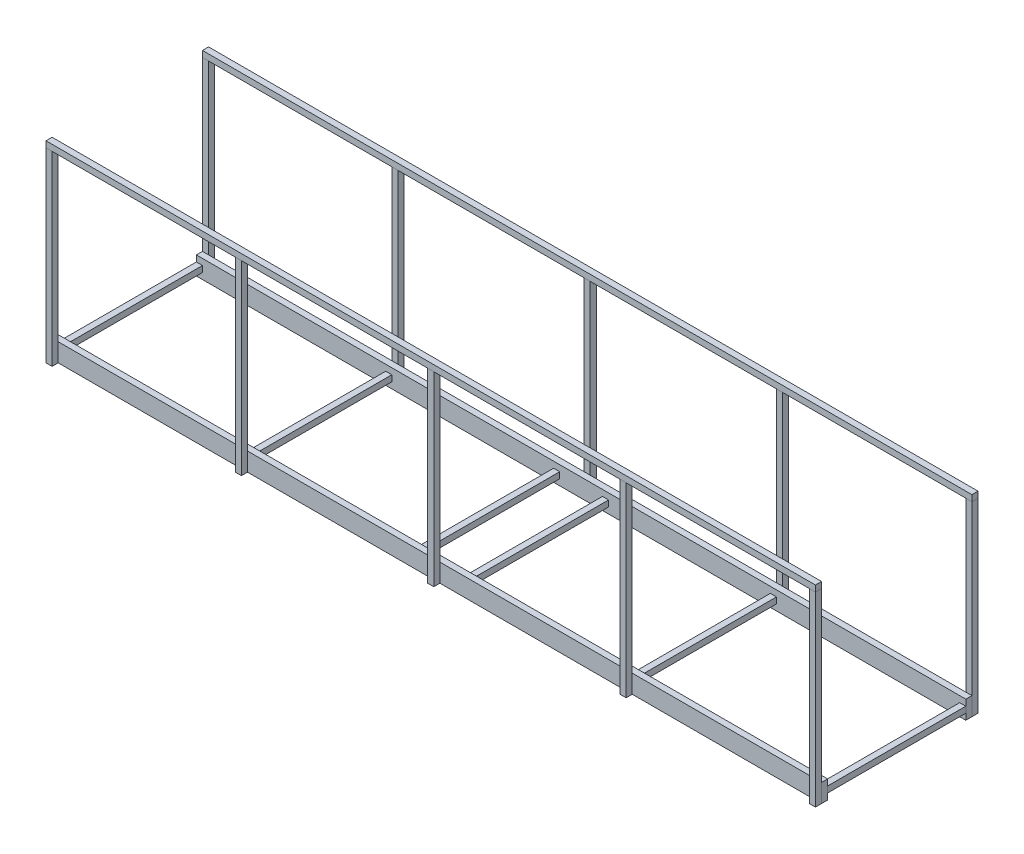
SolidWorks part; units mm, degrees
ref_plane "Front Plane" through (0, 0, 0) normal (0, 0, 1) x (1, 0, 0)
ref_plane "Top Plane" through (0, 0, 0) normal (0, 1, 0) x (1, 0, 0)
ref_plane "Right Plane" through (0, 0, 0) normal (1, 0, 0) x (0, 0, -1)
sketch "Sketch1" plane through (0, 0, 0) normal (0, 1, 0) x (1, 0, 0)
  line L0 (0, 37.5) -> (0, -37.5) construction
  line L1 (-200, -37.5) -> (200, -37.5)
  line L2 (-200, -37.5) -> (-200, 37.5)
  line L3 (-200, 37.5) -> (200, 37.5)
  line L4 (200, -37.5) -> (200, 37.5)
  line L5 (-200, -37.5) -> (200, 37.5) construction
  line L6 (-200, 37.5) -> (200, -37.5) construction
  line L7 (-100, 37.5) -> (-100, -37.5)
  line L8 (-12.7, -37.5) -> (-12.7, 37.5)
  line L9 (12.7, 37.5) -> (12.7, -37.5)
  line L10 (100, 37.5) -> (100, -37.5)
  point P0 (0, 0)
  dimension "D1" = 400
  dimension "D2" = 75
  dimension "D3" = 25.4
  dimension "D4" = 100
  dimension "D5" = 100
other "Structural Member1"
ref_plane "Plane1" through (-200, 0, 37.5) normal (1, 0, 0) x (0, 0, -1)
sketch "Sketch12" plane through (-200, 0, 37.5) normal (1, 0, 0) x (0, 0, -1)
  line L1 (-1.5875, -4.7625) -> (1.5875, -4.7625)
  line L2 (-1.5875, -4.7625) -> (-1.5875, 4.7625)
  line L3 (-1.5875, 4.7625) -> (1.5875, 4.7625)
  line L4 (1.5875, -4.7625) -> (1.5875, 4.7625)
  line L5 (-1.5875, -4.7625) -> (1.5875, 4.7625) construction
  line L6 (-1.5875, 4.7625) -> (1.5875, -4.7625) construction
  point P0 (0, 0)
  point P5 (0, 4.7625)
  point P6 (1.5875, 0)
  point P7 (0, -4.7625)
  point P8 (-1.5875, 0)
  point P9 (0, 0)
  dimension "D1" = 3.175
  dimension "D2" = 9.525
other "Structural Member2"
ref_plane "Plane2" through (200, 0, 37.5) normal (0, 0, -1) x (-1, 0, 0)
sketch "Sketch14" plane through (198.4125, 0, 37.5) normal (0, 0, -1) x (-1, 0, 0)
  line L1 (-1.5875, -1.5875) -> (1.5875, -1.5875)
  line L2 (-1.5875, -1.5875) -> (-1.5875, 1.5875)
  line L3 (-1.5875, 1.5875) -> (1.5875, 1.5875)
  line L4 (1.5875, -1.5875) -> (1.5875, 1.5875)
  line L5 (-1.5875, -1.5875) -> (1.5875, 1.5875) construction
  line L6 (-1.5875, 1.5875) -> (1.5875, -1.5875) construction
  point P0 (0, 0)
  point P5 (-1.5875, 0)
  point P6 (0, 1.5875)
  point P7 (1.5875, 0)
  point P8 (0, -1.5875)
  point P9 (0, 0)
  dimension "D1" = 3.175
other "Structural Member3"
ref_plane "Plane3" through (-200, 0, 37.5) normal (0, 0, -1) x (-1, 0, 0)
sketch "Sketch15" plane through (-198.4125, 0, 37.5) normal (0, 0, -1) x (-1, 0, 0)
  line L1 (-1.5875, -1.5875) -> (1.5875, -1.5875)
  line L2 (-1.5875, -1.5875) -> (-1.5875, 1.5875)
  line L3 (-1.5875, 1.5875) -> (1.5875, 1.5875)
  line L4 (1.5875, -1.5875) -> (1.5875, 1.5875)
  line L5 (-1.5875, -1.5875) -> (1.5875, 1.5875) construction
  line L6 (-1.5875, 1.5875) -> (1.5875, -1.5875) construction
  point P0 (0, 0)
  point P5 (-1.5875, 0)
  point P6 (0, 1.5875)
  point P7 (1.5875, 0)
  point P8 (0, -1.5875)
  point P9 (0, 0)
  dimension "D1" = 3.175
other "Structural Member4"
ref_plane "Plane4" through (-100, 0, -37.5) normal (0, 0, 1) x (1, 0, 0)
sketch "Sketch16" plane through (-100, 0, -37.5) normal (0, 0, 1) x (1, 0, 0)
  line L1 (-1.5875, -1.5875) -> (1.5875, -1.5875)
  line L2 (-1.5875, -1.5875) -> (-1.5875, 1.5875)
  line L3 (-1.5875, 1.5875) -> (1.5875, 1.5875)
  line L4 (1.5875, -1.5875) -> (1.5875, 1.5875)
  line L5 (-1.5875, -1.5875) -> (1.5875, 1.5875) construction
  line L6 (-1.5875, 1.5875) -> (1.5875, -1.5875) construction
  point P0 (0, 0)
  point P5 (-1.5875, 0)
  point P6 (0, 1.5875)
  point P7 (1.5875, 0)
  point P8 (0, -1.5875)
  point P9 (0, 0)
  dimension "D1" = 3.175
other "Trim/Extend1"
sketch "Sketch18" plane through (0, 0, 39.0875) normal (0, 0, 1) x (1, 0, 0)
  line L0 (-200, -4.7625) -> (-200, 95.2375)
  line L1 (-200, 95.2375) -> (200, 95.2375)
  line L2 (200, -4.7625) -> (200, 95.2375)
  line L3 (0, -4.7625) -> (0, 95.2375)
  line L4 (200, -4.7625) -> (-200, -4.7625) construction
  line L5 (-100, 95.2375) -> (-100, -4.7625)
  line L6 (100, 95.2375) -> (100, -4.7625)
  dimension "D1" = 100
  dimension "D2" = 100
  dimension "D3" = 100
other "Structural Member5"
ref_plane "Plane5" through (-200, -4.7625, 39.0875) normal (0, 1, 0) x (-1, 0, 0)
sketch "Sketch17" plane through (-198.4125, -4.7625, 40.675) normal (0, 1, 0) x (-1, 0, 0)
  line L1 (-1.5875, -1.5875) -> (1.5875, -1.5875)
  line L2 (-1.5875, -1.5875) -> (-1.5875, 1.5875)
  line L3 (-1.5875, 1.5875) -> (1.5875, 1.5875)
  line L4 (1.5875, -1.5875) -> (1.5875, 1.5875)
  line L5 (-1.5875, -1.5875) -> (1.5875, 1.5875) construction
  line L6 (-1.5875, 1.5875) -> (1.5875, -1.5875) construction
  point P0 (0, 0)
  point P5 (-1.5875, 0)
  point P6 (0, 1.5875)
  point P7 (1.5875, 0)
  point P8 (0, -1.5875)
  point P9 (0, 0)
  dimension "D1" = 3.175
other "Structural Member6"
ref_plane "Plane6" through (200, -4.7625, 39.0875) normal (0, 1, 0) x (-1, 0, 0)
sketch "Sketch19" plane through (198.4125, -4.7625, 40.675) normal (0, 1, 0) x (-1, 0, 0)
  line L1 (-1.5875, -1.5875) -> (1.5875, -1.5875)
  line L2 (-1.5875, -1.5875) -> (-1.5875, 1.5875)
  line L3 (-1.5875, 1.5875) -> (1.5875, 1.5875)
  line L4 (1.5875, -1.5875) -> (1.5875, 1.5875)
  line L5 (-1.5875, -1.5875) -> (1.5875, 1.5875) construction
  line L6 (-1.5875, 1.5875) -> (1.5875, -1.5875) construction
  point P0 (0, 0)
  point P5 (-1.5875, 0)
  point P6 (0, 1.5875)
  point P7 (1.5875, 0)
  point P8 (0, -1.5875)
  point P9 (0, 0)
  dimension "D1" = 3.175
other "Structural Member7"
ref_plane "Plane7" through (100, 95.2375, 39.0875) normal (0, -1, 0) x (1, 0, 0)
sketch "Sketch110" plane through (100, 95.2375, 40.675) normal (0, -1, 0) x (1, 0, 0)
  line L1 (-1.5875, -1.5875) -> (1.5875, -1.5875)
  line L2 (-1.5875, -1.5875) -> (-1.5875, 1.5875)
  line L3 (-1.5875, 1.5875) -> (1.5875, 1.5875)
  line L4 (1.5875, -1.5875) -> (1.5875, 1.5875)
  line L5 (-1.5875, -1.5875) -> (1.5875, 1.5875) construction
  line L6 (-1.5875, 1.5875) -> (1.5875, -1.5875) construction
  point P0 (0, 0)
  point P5 (-1.5875, 0)
  point P6 (0, 1.5875)
  point P7 (1.5875, 0)
  point P8 (0, -1.5875)
  point P9 (0, 0)
  dimension "D1" = 3.175
other "Structural Member8"
ref_plane "Plane8" through (-200, 95.2375, 39.0875) normal (1, 0, 0) x (0, 1, 0)
sketch "Sketch111" plane through (-200, 93.65, 40.675) normal (1, 0, 0) x (0, 1, 0)
  line L1 (-1.5875, -1.5875) -> (1.5875, -1.5875)
  line L2 (-1.5875, -1.5875) -> (-1.5875, 1.5875)
  line L3 (-1.5875, 1.5875) -> (1.5875, 1.5875)
  line L4 (1.5875, -1.5875) -> (1.5875, 1.5875)
  line L5 (-1.5875, -1.5875) -> (1.5875, 1.5875) construction
  line L6 (-1.5875, 1.5875) -> (1.5875, -1.5875) construction
  point P0 (0, 0)
  point P5 (-1.5875, 0)
  point P6 (0, 1.5875)
  point P7 (1.5875, 0)
  point P8 (0, -1.5875)
  point P9 (0, 0)
  dimension "D1" = 3.175
other "Trim/Extend2"
sketch "Sketch124" plane through (0, 0, -39.0875) normal (0, 0, -1) x (-1, 0, 0)
  line L0 (-200, -4.7625) -> (-200, 95.2375)
  line L1 (200, -4.7625) -> (200, 95.2375)
  line L2 (0, -4.7625) -> (0, 95.2375)
  line L3 (-200, -4.7625) -> (200, -4.7625) construction
  line L4 (-100, -4.7625) -> (-100, 95.2375)
  line L5 (100, -4.7625) -> (100, 95.2375)
  line L6 (200, 95.2375) -> (-200, 95.2375)
  line L7 (200, 95.2375) -> (-200, 95.2375) construction
  line L8 (-100, 95.2375) -> (-100, -4.7625) construction
  line L9 (100, 95.2375) -> (100, -4.7625) construction
other "Structural Member15"
ref_plane "Plane16" through (200, -4.7625, -39.0875) normal (0, 1, 0) x (1, 0, 0)
sketch "Sketch125" plane through (198.4125, -4.7625, -40.675) normal (0, 1, 0) x (1, 0, 0)
  line L1 (-1.5875, -1.5875) -> (1.5875, -1.5875)
  line L2 (-1.5875, -1.5875) -> (-1.5875, 1.5875)
  line L3 (-1.5875, 1.5875) -> (1.5875, 1.5875)
  line L4 (1.5875, -1.5875) -> (1.5875, 1.5875)
  line L5 (-1.5875, -1.5875) -> (1.5875, 1.5875) construction
  line L6 (-1.5875, 1.5875) -> (1.5875, -1.5875) construction
  point P0 (0, 0)
  point P5 (-1.5875, 0)
  point P6 (0, 1.5875)
  point P7 (1.5875, 0)
  point P8 (0, -1.5875)
  point P9 (0, 0)
  dimension "D1" = 3.175
other "Structural Member16"
ref_plane "Plane17" through (-200, -4.7625, -39.0875) normal (0, 1, 0) x (1, 0, 0)
sketch "Sketch126" plane through (-198.4125, -4.7625, -40.675) normal (0, 1, 0) x (1, 0, 0)
  line L1 (-1.5875, -1.5875) -> (1.5875, -1.5875)
  line L2 (-1.5875, -1.5875) -> (-1.5875, 1.5875)
  line L3 (-1.5875, 1.5875) -> (1.5875, 1.5875)
  line L4 (1.5875, -1.5875) -> (1.5875, 1.5875)
  line L5 (-1.5875, -1.5875) -> (1.5875, 1.5875) construction
  line L6 (-1.5875, 1.5875) -> (1.5875, -1.5875) construction
  point P0 (0, 0)
  point P5 (-1.5875, 0)
  point P6 (0, 1.5875)
  point P7 (1.5875, 0)
  point P8 (0, -1.5875)
  point P9 (0, 0)
  dimension "D1" = 3.175
other "Structural Member17"
ref_plane "Plane18" through (100, -4.7625, -39.0875) normal (0, 1, 0) x (1, 0, 0)
sketch "Sketch127" plane through (100, -4.7625, -40.675) normal (0, 1, 0) x (1, 0, 0)
  line L1 (-1.5875, -1.5875) -> (1.5875, -1.5875)
  line L2 (-1.5875, -1.5875) -> (-1.5875, 1.5875)
  line L3 (-1.5875, 1.5875) -> (1.5875, 1.5875)
  line L4 (1.5875, -1.5875) -> (1.5875, 1.5875)
  line L5 (-1.5875, -1.5875) -> (1.5875, 1.5875) construction
  line L6 (-1.5875, 1.5875) -> (1.5875, -1.5875) construction
  point P0 (0, 0)
  point P5 (-1.5875, 0)
  point P6 (0, 1.5875)
  point P7 (1.5875, 0)
  point P8 (0, -1.5875)
  point P9 (0, 0)
  dimension "D1" = 3.175
other "Structural Member18"
ref_plane "Plane19" through (-200, 95.2375, -39.0875) normal (1, 0, 0) x (0, -1, 0)
sketch "Sketch128" plane through (-200, 93.65, -40.675) normal (1, 0, 0) x (0, -1, 0)
  line L1 (-1.5875, -1.5875) -> (1.5875, -1.5875)
  line L2 (-1.5875, -1.5875) -> (-1.5875, 1.5875)
  line L3 (-1.5875, 1.5875) -> (1.5875, 1.5875)
  line L4 (1.5875, -1.5875) -> (1.5875, 1.5875)
  line L5 (-1.5875, -1.5875) -> (1.5875, 1.5875) construction
  line L6 (-1.5875, 1.5875) -> (1.5875, -1.5875) construction
  point P0 (0, 0)
  point P5 (-1.5875, 0)
  point P6 (0, 1.5875)
  point P7 (1.5875, 0)
  point P8 (0, -1.5875)
  point P9 (0, 0)
  dimension "D1" = 3.175
other "Trim/Extend3"
equation "\"D2@Sketch12\" = \"D1@Sketch12\" * 3"
